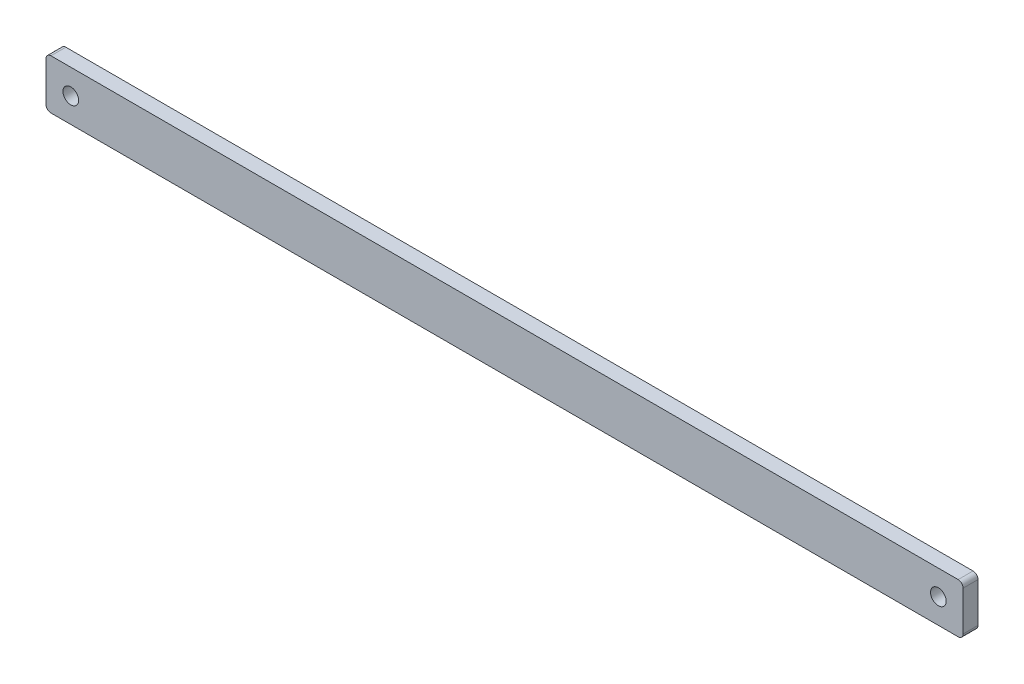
SolidWorks part; units mm, degrees
ref_plane "Front Plane" through (0, 0, 0) normal (0, 0, 1) x (1, 0, 0)
ref_plane "Top Plane" through (0, 0, 0) normal (0, 1, 0) x (1, 0, 0)
ref_plane "Right Plane" through (0, 0, 0) normal (1, 0, 0) x (0, 0, -1)
sketch "Sketch1" plane through (0, 0, 0) normal (0, 0, 1) x (1, 0, 0)
  line L1 (0, 0) -> (469.9, 0)
  line L2 (0, 0) -> (0, 25.4)
  line L3 (0, 25.4) -> (469.9, 25.4)
  line L4 (469.9, 0) -> (469.9, 25.4)
  dimension "D1" = 25.4
  dimension "D2" = 469.9
extrude "Boss-Extrude1" add sketch "Sketch1" along normal blind 7.62
sketch "Sketch2" plane through (0, 0, 7.62) normal (0, 0, 1) x (1, 0, 0)
  line L0 (469.9, 12.7) -> (0, 12.7) construction
  line L1 (469.9, 0) -> (469.9, 25.4) construction
  line L2 (0, 25.4) -> (0, 0) construction
  circle A0 centre (12.7, 12.7) radius 4
  dimension "D1" = 8
  dimension "D2" = 12.7
extrude "Cut-Extrude1" cut sketch "Sketch2" against normal through all
ref_plane "Plane1" through (234.95, 0, 0) normal (1, 0, 0) x (0, 0, -1)
mirror "Mirror1" about plane through (234.95, 0, 0) normal (1, 0, 0) of "Cut-Extrude1"
fillet "Fillet1" radius 2.54 4 edges at (0, 25.4, 3.81) (0, 0, 3.81) (469.9, 0, 3.81) (469.9, 25.4, 3.81)
